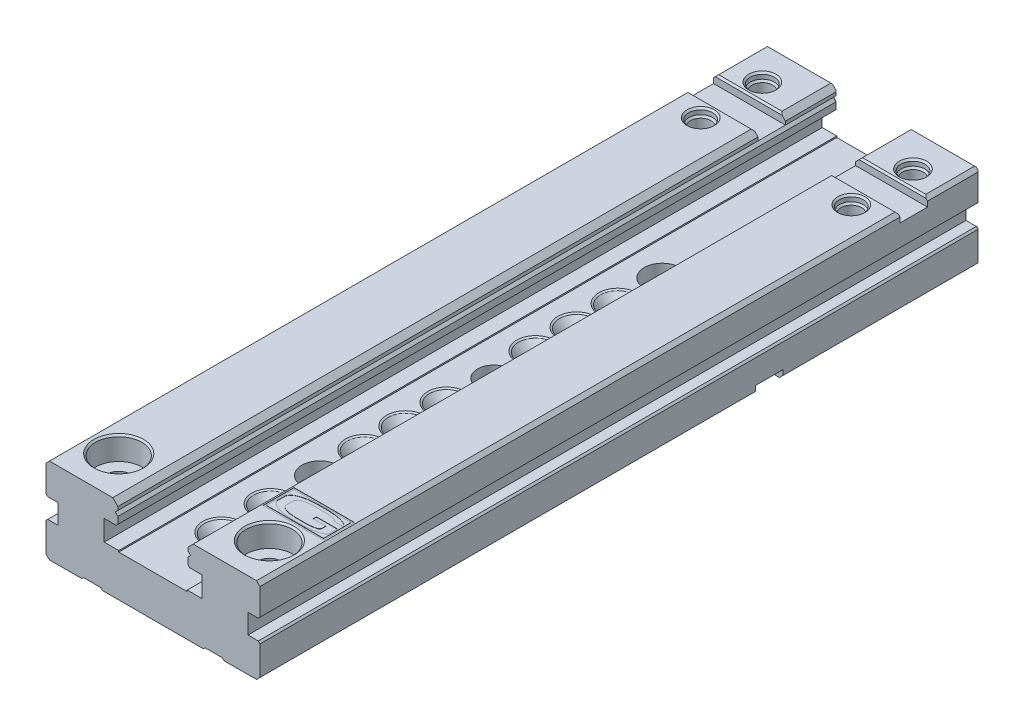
SolidWorks part; units mm, degrees
ref_plane "Front Plane" through (0, 0, 0) normal (0, 0, 1) x (1, 0, 0)
ref_plane "Top Plane" through (0, 0, 0) normal (0, 1, 0) x (1, 0, 0)
ref_plane "Right Plane" through (0, 0, 0) normal (1, 0, 0) x (0, 0, -1)
imported_body "Imported1"
sketch "Sketch1" plane through (0, 24.2, 0) normal (0, 1, 0) x (1, 0, 0)
  circle A0 centre (0, 297.5) radius 12.4968
  circle A1 centre (0, 197.5) radius 11.5
  circle A2 centre (0, 97.5) radius 12.4968
extrude "Boss-Extrude1" add sketch "Sketch1" against normal up to surface (18.2 mm away)
hole_wizard "Hole1" positions "Sketch3" profile "Sketch2" legacy
sketch "Sketch3" plane through (0, 24.2, 0) normal (0, 1, 0) x (1, 0, 0)
  line L0 (-20.5, 420) -> (20.5, 420) construction
  point P0 (0, 297.5)
  point P6 (0, 97.5)
  dimension "D1" = 122.5
  dimension "D2" = 200
sketch "Sketch2" plane through (0, 24.2, -297.5) normal (1, 0, 0) x (0, 0, 1)
  line L0 (0, 0) -> (0, 100)
  line L1 (0, 100) -> (8, 100)
  line L2 (8, 100) -> (8, 8)
  line L3 (8, 8) -> (10.5, 8)
  line L4 (10.5, 8) -> (10.5, 0)
  line L5 (10.5, 0) -> (0, 0)
  line L6 (0, 110) -> (0, -10) construction
  dimension "Diameter" = 16
  dimension "Depth" = 100
  dimension "C-Bore Diameter" = 21
  dimension "C-Bore Depth" = 8
hole_wizard "Hole2" positions "Sketch5" profile "Sketch4" legacy
sketch "Sketch5" plane through (0, 24.2, 0) normal (0, 1, 0) x (1, 0, 0)
  circle A0 centre (0, 297.5) radius 10.5 construction
  point P0 (1.6041, 197.5)
  dimension "D1" = 100
sketch "Sketch4" plane through (1.6041, 24.2, -197.5) normal (1, 0, 0) x (0, 0, 1)
  line L0 (0, 0) -> (0, 100)
  line L1 (0, 100) -> (6.5, 100)
  line L2 (6.5, 100) -> (6.5, 12.5)
  line L3 (6.5, 12.5) -> (9.5, 12.5)
  line L4 (9.5, 12.5) -> (9.5, 0)
  line L5 (9.5, 0) -> (0, 0)
  line L6 (0, 110) -> (0, -10) construction
  dimension "Diameter" = 13
  dimension "Depth" = 100
  dimension "C-Bore Diameter" = 19
  dimension "C-Bore Depth" = 12.5
